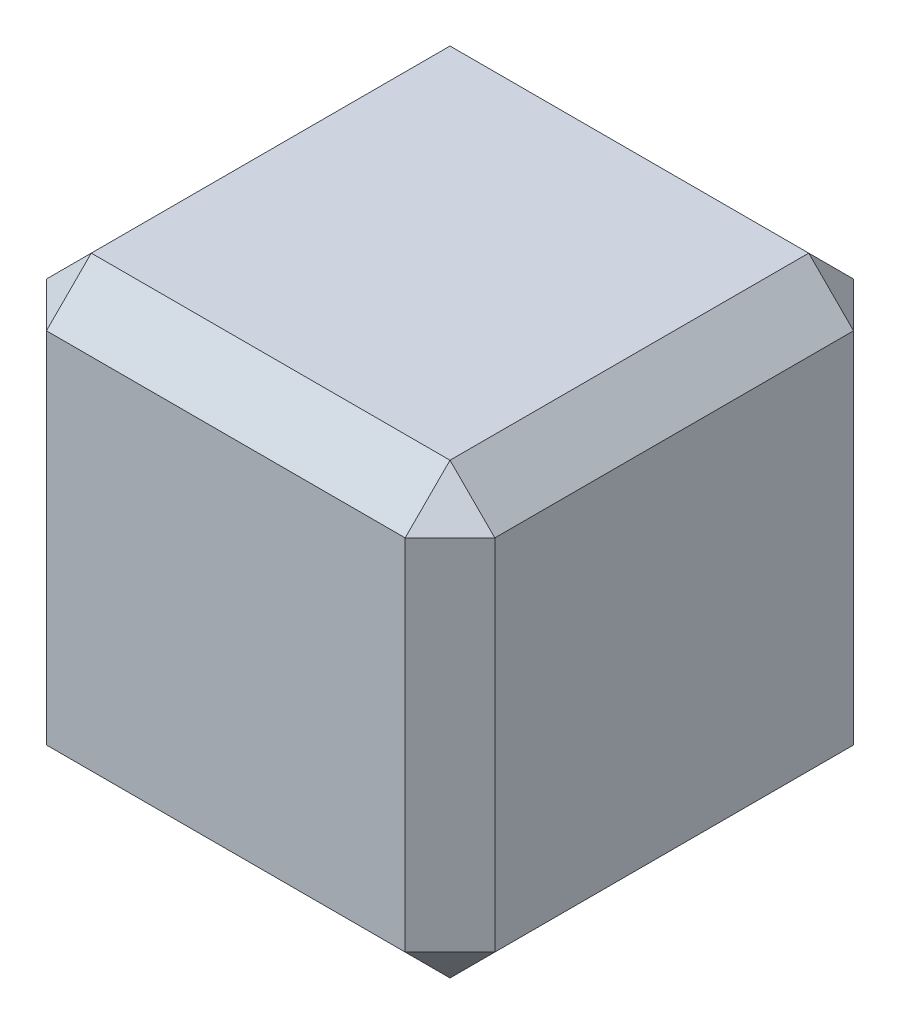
SolidWorks part; units mm, degrees
ref_plane "Front Plane" through (0, 0, 0) normal (0, 0, 1) x (1, 0, 0)
ref_plane "Top Plane" through (0, 0, 0) normal (0, 1, 0) x (1, 0, 0)
ref_plane "Right Plane" through (0, 0, 0) normal (1, 0, 0) x (0, 0, -1)
sketch "Sketch1" plane through (0, 0, 0) normal (0, 0, 1) x (1, 0, 0)
  line L1 (0, 0) -> (10, 0)
  line L2 (0, 0) -> (0, 10)
  line L3 (0, 10) -> (10, 10)
  line L4 (10, 0) -> (10, 10)
  dimension "D1" = 10
  dimension "D2" = 10
extrude "Boss-Extrude1" add sketch "Sketch1" along normal blind 10
chamfer "Chamfer1" distance 1 angle 45 12 edges at (10, 5, 10) (0, 5, 10) (10, 10, 5) (5, 10, 10) (0, 10, 5) (0, 0, 5) (5, 0, 10) (10, 0, 5) (5, 0, 0) (10, 5, 0) (5, 10, 0) (0, 5, 0)
